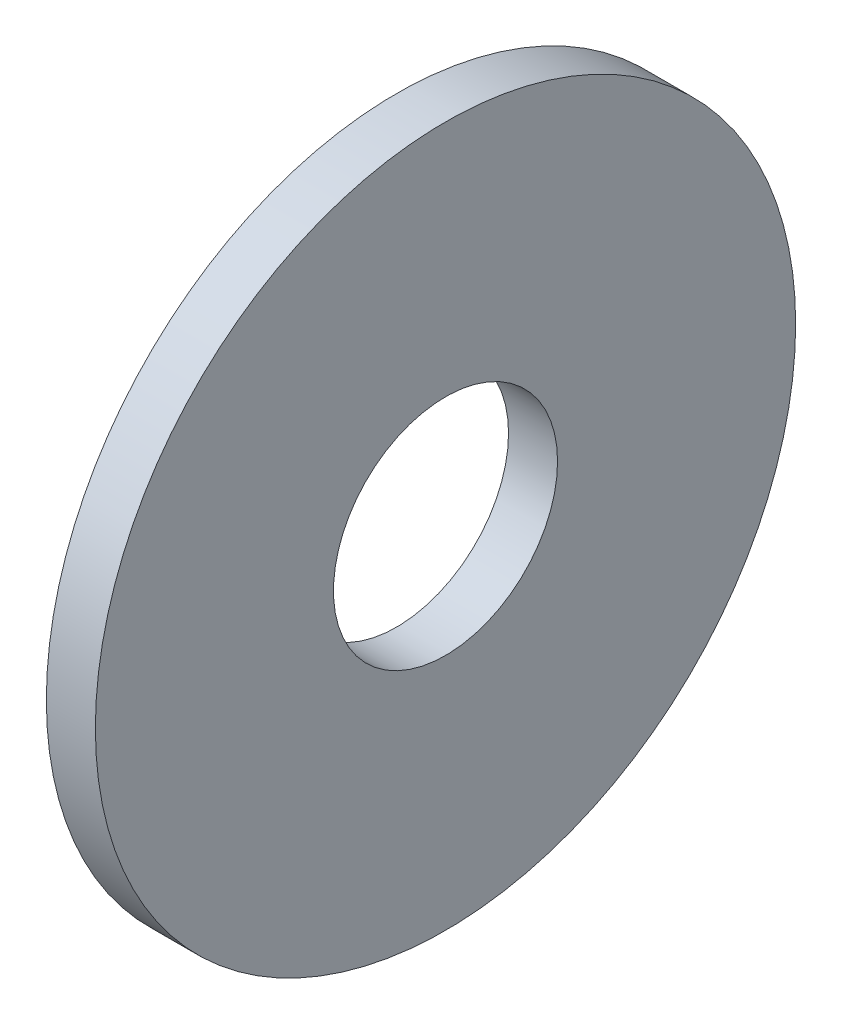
SolidWorks part; units mm, degrees
ref_plane "Front Plane" through (0, 0, 0) normal (0, 0, 1) x (1, 0, 0)
ref_plane "Top Plane" through (0, 0, 0) normal (0, 1, 0) x (1, 0, 0)
ref_plane "Right Plane" through (0, 0, 0) normal (1, 0, 0) x (0, 0, -1)
sketch "Sketch1" plane through (0, 0, 0) normal (1, 0, 0) x (0, 0, -1)
  circle A0 centre (0, 0) radius 3.2
  circle A1 centre (0, 0) radius 10
  dimension "D1" = 6.4
  dimension "D2" = 20
extrude "Boss-Extrude1" add sketch "Sketch1" along normal blind 1.4
